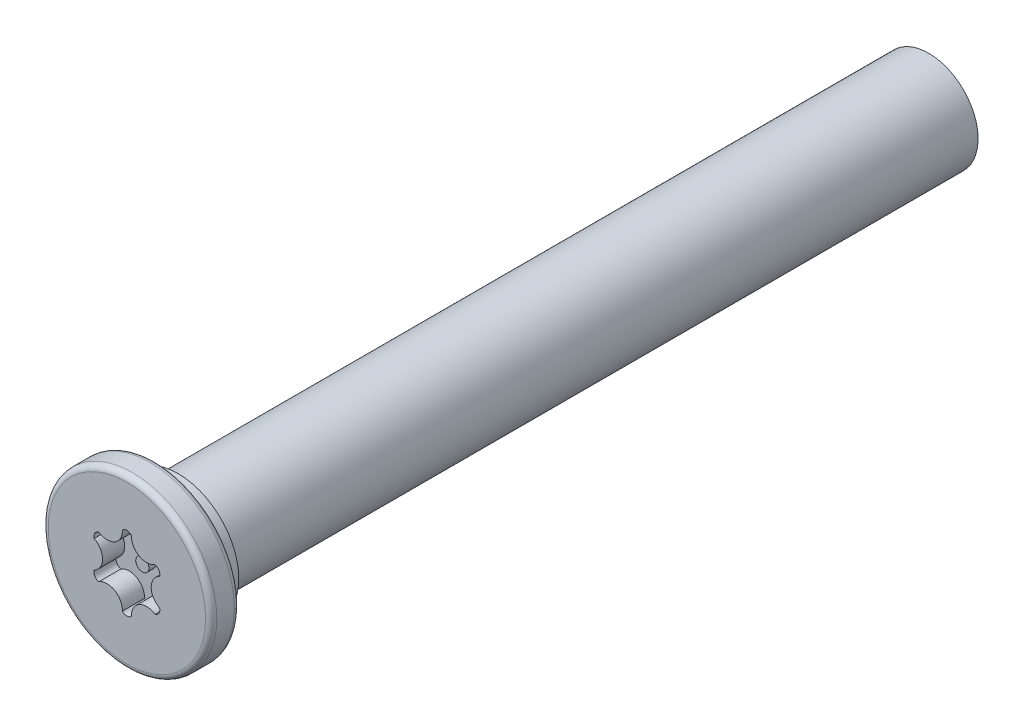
SolidWorks part; units mm, degrees
ref_plane "Front Plane" through (0, 0, 0) normal (0, 0, 1) x (1, 0, 0)
ref_plane "Top Plane" through (0, 0, 0) normal (0, 1, 0) x (1, 0, 0)
ref_plane "Right Plane" through (0, 0, 0) normal (1, 0, 0) x (0, 0, -1)
sketch "Sketch2" plane through (0, 0, 0) normal (1, 0, 0) x (0, 0, -1)
  line L1 (0, 0) -> (1.3, 0)
  line L2 (0, 0) -> (0, 3.81)
  line L3 (0, 3.81) -> (1.3, 3.81)
  line L4 (1.3, 0) -> (1.3, 3.81)
  line L5 (1.3, 0) -> (14, 0)
  line L6 (1.3, 0) -> (1.3, 2.23)
  line L7 (1.3, 2.23) -> (14, 2.23)
  line L8 (14, 0) -> (14, 2.23)
  dimension "D1" = 3.81
  dimension "D2" = 1.3
  dimension "D3" = 12.7
  dimension "D4" = 2.23
revolve "Revolve1" add sketch "Sketch2" angle 360 about L5
sketch "Sketch3" plane through (0, 0, 0) normal (0, 0, 1) x (1, 0, 0)
  line L0 (0, 1.3843) -> (0, 0)
  line L3 (1.1845, -1.0048) -> (2.4257, -1.0048)
  line L4 (0, 1.675) -> (0, 1.6727)
  line L5 (0, 1.675) -> (0, 1.6727)
  line L6 (0, 1.6727) -> (0, 1.675)
  line L8 (1.0407, 1.8026) -> (1.1012, 1.9073)
  line L9 (1.3857, 1.205) -> (2.5818, 1.205)
  line L10 (0, 0) -> (0.8375, 1.4506)
  line L11 (0, 0) -> (2.5818, 0)
  line L14 (2.5818, 0) -> (2.5818, 1.205)
  line L15 (1.3857, 1.205) -> (-0.1691, 1.205)
  circle A0 centre (0, 0) radius 1.675
  arc A7 (1.1845, -1.0048) -> (1.0345, -1.0748) centre (0.8546, -0.4934) cw
  arc A16 (-0.2051, 1.5894) -> (0.2051, 1.5894) centre (0, 1.3843) cw
  arc A18 (0.2051, 1.5894) -> (1.2739, 0.9723) centre (0.8938, 1.5482) ccw
  arc A19 (1.479, 0.6171) -> (1.479, -0.6171) centre (1.7877, 0) ccw
  arc A20 (1.2739, 0.9723) -> (1.479, 0.6171) centre (1.1988, 0.6922) cw
  arc A21 (1.2739, -0.9723) -> (0.2051, -1.5894) centre (0.8938, -1.5482) ccw
  arc A22 (1.479, -0.6171) -> (1.2739, -0.9723) centre (1.1988, -0.6922) cw
  arc A23 (-0.2051, -1.5894) -> (-1.2739, -0.9723) centre (-0.8938, -1.5482) ccw
  arc A24 (0.2051, -1.5894) -> (-0.2051, -1.5894) centre (0, -1.3843) cw
  arc A25 (-1.479, -0.6171) -> (-1.479, 0.6171) centre (-1.7877, 0) ccw
  arc A26 (-1.2739, -0.9723) -> (-1.479, -0.6171) centre (-1.1988, -0.6922) cw
  arc A27 (-1.2739, 0.9723) -> (-0.2051, 1.5894) centre (-0.8938, 1.5482) ccw
  arc A28 (-1.479, 0.6171) -> (-1.2739, 0.9723) centre (-1.1988, 0.6922) cw
  point P38 (0, 0)
  point P52 (0, 0)
  dimension "D1" = 3.35
  dimension "D4" = 1.205
  dimension "D2" = 6
  dimension "D5" = 60
extrude "Cut-Extrude3" cut sketch "Sketch3" against normal blind 1
fillet "Fillet12" radius 0.254 2 edges at (3.81, 0, 0) (3.81, 0, -1.3)
sketch "Sketch7" plane through (0, 0, -14) normal (0, 0, -1) x (-1, 0, 0)
  circle A0 centre (0, 0) radius 2.23
  dimension "D1" = 4.46
extrude "Cut-Extrude6" cut sketch "Sketch7" against normal blind 12.7
sketch "Sketch11" plane through (0, 0, -1.3) normal (0, 0, -1) x (-1, 0, 0)
  circle A0 centre (0, 0) radius 2.23
  circle A1 centre (0, 0) radius 2.738
extrude "Boss-Extrude1" add sketch "Sketch11" along normal blind 1.016
sketch "Sketch12" plane through (0, 0, -1.3) normal (0, 0, -1) x (-1, 0, 0)
  circle A0 centre (0, 0) radius 2.23
extrude "Boss-Extrude2" add sketch "Sketch12" along normal blind 12.7
sketch "Sketch14" plane through (0, 0, -1) normal (0, 0, 1) x (1, 0, 0)
  circle A0 centre (0, 0) radius 0.3
extrude "Boss-Extrude4" add sketch "Sketch14" along normal blind 0.3
sketch "Sketch15" plane through (0, 0, -14) normal (0, 0, -1) x (-1, 0, 0)
  circle A0 centre (0, 0) radius 2.23
extrude "Cut-Extrude7" cut sketch "Sketch15" against normal blind 12.7
sketch "Sketch16" plane through (0, 0, -1.3) normal (0, 0, -1) x (-1, 0, 0)
  circle A0 centre (0, 0) radius 2.23
extrude "Boss-Extrude5" add sketch "Sketch16" along normal blind 34.925
